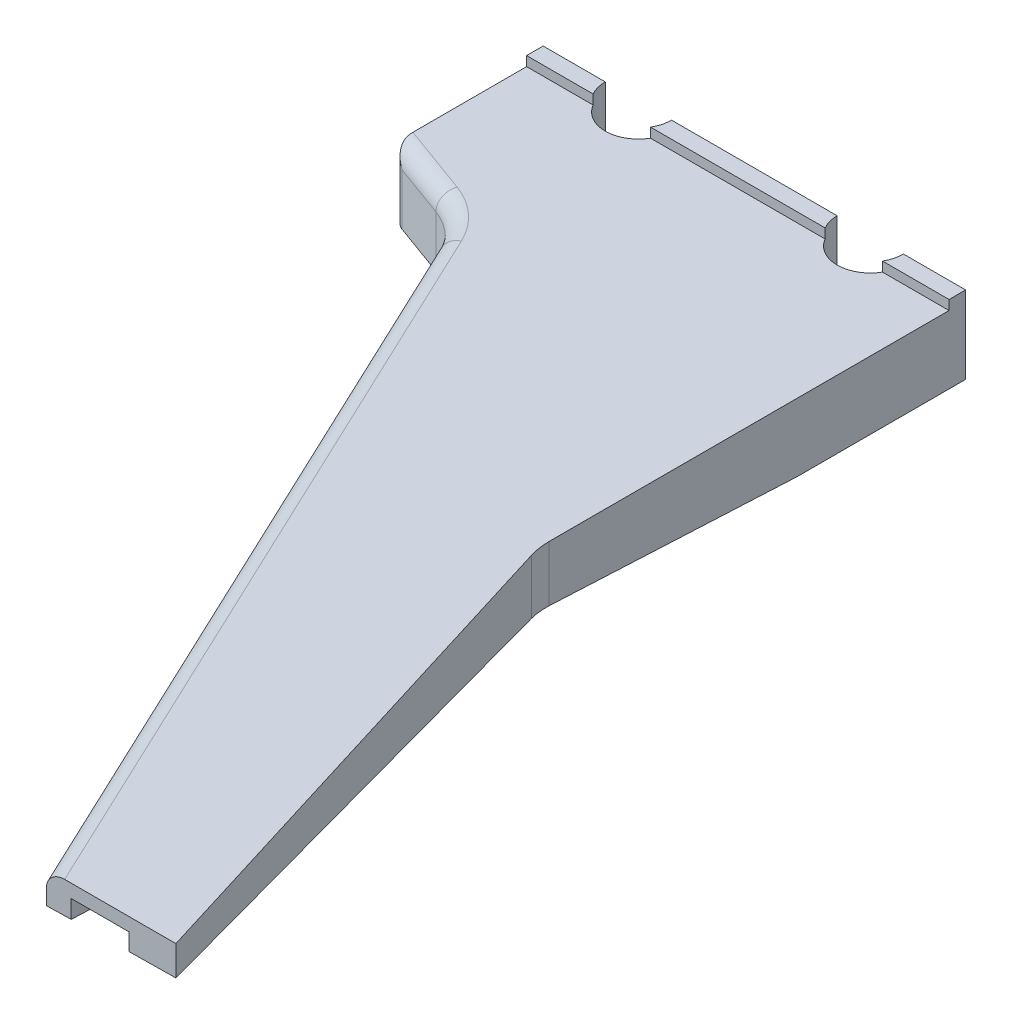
SolidWorks part; units mm, degrees
other "<9-Voilure Droite>-<Enlèv. mat.-Extru.4>"
ref_plane "Plan de face" through (0, 0, 0) normal (0, 0, 1) x (1, 0, 0)
ref_plane "Plan de dessus" through (0, 0, 0) normal (0, 1, 0) x (1, 0, 0)
ref_plane "Plan de droite" through (0, 0, 0) normal (1, 0, 0) x (0, 0, -1)
sketch "Esquisse1-9-Voilure Droite_Symétrique" plane through (0, 0, 0) normal (0, -1, 0) x (1, 0, 0)
  line L0 (0, 0) -> (51, 0)
  line L1 (51, 0) -> (51, 33.7)
  line L2 (51, 33.7) -> (70.5168, 97)
  line L4 (54.8814, 97) -> (11, 4.0037)
  line L5 (11, 4.0037) -> (0, 0)
  line L6 (54.8814, 97) -> (70.5168, 97)
  dimension "D2" = 33.7
  dimension "D3" = 11
  dimension "D4" = 20
  dimension "D5" = 51
  dimension "D6" = 15.6354
  dimension "D7" = 97
  dimension "D8" = 64.739
  dimension "D9" = 72.864
  dimension "D11" = 19.5168
sketch "Esquisse5-9-Voilure Droite_Symétrique" plane through (0, 8.2, 0) normal (0, -1, 0) x (1, 0, 0)
  line L0 (62.6991, 97) -> (25.5, 0) construction
sketch "Esquisse6-9-Voilure Droite_Symétrique" plane through (22.2306, 0, -8.5253) normal (0.9337, 0, -0.3581) x (-0.3581, 0, -0.9337)
  line L0 (-113.019, 0) -> (-113.019, 4.5) construction
  line L2 (-15, 8.2) -> (-15, 0) construction
  line L5 (-218.019, 9.3205) -> (-15, 0)
  line L6 (-15, 0) -> (90, 0)
  dimension "D1" = 4.5
  dimension "D2" = 105
  dimension "D3" = 105
sketch "Esquisse7-9-Voilure Droite_Symétrique" plane through (0, 9.3205, 0) normal (0, -1, 0) x (-1, 0, 0)
  line L0 (-100.2962, -195.038) -> (-118.1997, -241.7228) construction
  circle A0 centre (-118.1997, -241.7228) radius 50
  dimension "D1" = 100
sketch "Esquisse8-9-Voilure Droite_Symétrique" plane through (0, 0, 0) normal (0, 0, 1) x (1, 0, 0)
  line L8 (0, 0) -> (51, 0)
  line L9 (51, 0) -> (51, 8.2)
  line L10 (51, 8.2) -> (0, 8.2)
  line L11 (0, 8.2) -> (0, 0)
sketch "Esquisse14-9-Voilure Droite_Symétrique" plane through (0, 0, 0) normal (0, 1, 0) x (1, 0, 0)
  line L0 (12.1651, -28.5) -> (43, -28.5) construction
  line L1 (12.1651, -26) -> (43, -26)
  line L2 (12.1651, -31) -> (43, -31)
  arc A0 (12.1651, -26) -> (12.1651, -31) centre (12.1651, -28.5) ccw
  arc A1 (43, -31) -> (43, -26) centre (43, -28.5) ccw
  point P2 (27.5825, -28.5)
  dimension "D1" = 2.5
sketch "Esquisse15-9-Voilure Droite_Symétrique" plane through (0, 0, 97) normal (0, 0, -1) x (-1, 0, 0)
  line L0 (-57.8814, 1.5969) -> (-57.8814, 6.5969)
  line L1 (-57.8814, 6.5969) -> (-64.8814, 6.5969)
  line L2 (-64.8814, 6.5969) -> (-64.8814, 1.5969)
  line L4 (-64.8814, 1.5969) -> (-57.8814, 1.5969)
  dimension "D2" = 7
  dimension "D3" = 5
sketch "Esquisse16-9-Voilure Droite_Symétrique" plane through (0, 0, 0) normal (1, 0, 0) x (0, 0, -1)
  line L5 (11, 8.2) -> (11, 0)
  line L6 (11, 0) -> (17.8509, 0)
  line L7 (17.8509, 0) -> (17.8509, 9.3556)
  line L8 (17.8509, 9.3556) -> (15.8509, 9.3556)
  line L9 (15.8509, 9.3556) -> (15.8509, 8.2)
  line L10 (11, 8.2) -> (15.8509, 8.2)
sketch "Esquisse17-9-Voilure Droite_Symétrique" plane through (0, 0, 0) normal (0, 1, 0) x (1, 0, 0)
  circle A0 centre (11.5, 17.8509) radius 4
  circle A1 centre (39.5, 17.8509) radius 4
  dimension "D1" = 8
  dimension "D2" = 8
  dimension "D4" = 28
sketch "Trajectoire Fraise diam. 100-9-Voilure Droite_Symétrique" plane through (22.2306, 0, -8.5253) normal (0.9337, 0, -0.3581) x (-0.3581, 0, -0.9337)
  line L2 (-218.019, 9.3205) -> (-15, 0) construction
  line L3 (-15, 0) -> (90, 0) construction
  line L4 (-175.8183, 5.0876) -> (-65, 0)
  line L5 (-65, 0) -> (76.6673, 0)
  line L7 (-175.8183, 14.8789) -> (-175.8183, -22.4728) construction
  dimension "D1" = 50
mirrored part "9-Voilure Droite_Symétrique"
